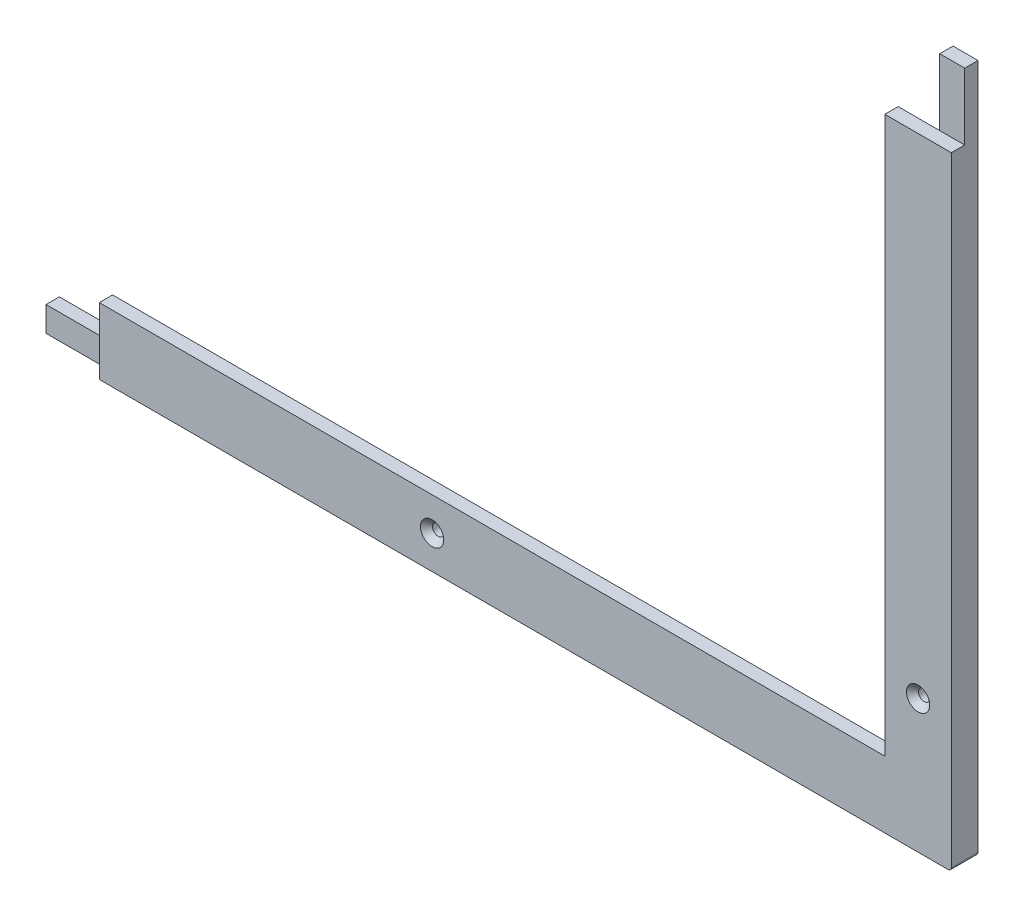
SolidWorks part; units mm, degrees
ref_plane "Ebene vorne" through (0, 0, 0) normal (0, 0, 1) x (1, 0, 0)
ref_plane "Ebene oben" through (0, 0, 0) normal (0, 1, 0) x (1, 0, 0)
ref_plane "Ebene rechts" through (0, 0, 0) normal (1, 0, 0) x (0, 0, -1)
sketch "Skizze1" plane through (0, 0, 0) normal (0, 0, 1) x (1, 0, 0)
  line L1 (-246, -177) -> (246, -177)
  line L2 (-246, -177) -> (-246, 177)
  line L3 (-246, 177) -> (246, 177)
  line L4 (246, -177) -> (246, 177)
  line L5 (-246, -177) -> (246, 177) construction
  line L6 (-246, 177) -> (246, -177) construction
  line L7 (-266, -197) -> (266, -197)
  line L8 (-266, -197) -> (-266, 197)
  line L9 (-266, 197) -> (266, 197)
  line L10 (266, -197) -> (266, 197)
  line L11 (-266, -197) -> (266, 197) construction
  line L12 (-266, 197) -> (266, -197) construction
  point P0 (0, 0)
  point P6 (0, 0)
  dimension "D1" = 532
  dimension "D2" = 394
  dimension "D3" = 20
  dimension "D4" = 20
extrude "Aufsatz-Linear austragen1" add sketch "Skizze1" along normal blind 8
fillet "Verrundung1" radius 1 4 edges at (-266, 197, 4) (-266, -197, 4) (266, -197, 4) (266, 197, 4)
sketch "Skizze2" plane through (0, 0, 0) normal (0, 0, -1) x (-1, 0, 0)
  line L0 (-266, -196) -> (-266, 196) construction
  line L1 (-258.5, 189.5) -> (258.5, 189.5)
  line L2 (-258.5, 189.5) -> (-258.5, -189.5)
  line L3 (-258.5, -189.5) -> (258.5, -189.5)
  line L4 (258.5, 189.5) -> (258.5, -189.5)
  line L5 (-265, 197) -> (265, 197) construction
  line L6 (266, 196) -> (266, -196) construction
  line L7 (265, -197) -> (-265, -197) construction
  dimension "D1" = 7.5
  dimension "D2" = 7.5
  dimension "D3" = 7.5
  dimension "D4" = 7.5
extrude "Schnitt-Linear austragen1" cut sketch "Skizze2" against normal blind 4
hole_wizard "Formsenkung für M3 Senkschraube mit Innensechskant1" positions "Skizze3" profile "Skizze4" countersink size "M3" standard "DIN"
sketch "Skizze3" plane through (0, 0, 8) normal (0, 0, 1) x (1, 0, 0)
  line L0 (-266, 196) -> (-266, -196) construction
  line L1 (266, -196) -> (266, 196) construction
  line L2 (-265, -197) -> (265, -197) construction
  line L3 (265, 197) -> (-265, 197) construction
  point P0 (-110, -187)
  point P2 (110, -187)
  point P4 (110, 187)
  point P6 (-110, 187)
  point P8 (256, 157)
  point P10 (256, -157)
  point P12 (-256, -157)
  point P14 (-256, 157)
  point P26 (-256, 0)
  point P32 (256, 0)
  dimension "D1" = 156
  dimension "D2" = 156
  dimension "D3" = 10
  dimension "D4" = 10
  dimension "D5" = 10
  dimension "D6" = 10
  dimension "D7" = 40
  dimension "D8" = 40
sketch "Skizze4" plane through (-110, -187, 8) normal (1, 0, 0) x (0, -1, 0)
  line L0 (0, 0) -> (0, 8)
  line L1 (0, 8) -> (1.7, 8)
  line L2 (1.7, 8) -> (1.7, 1.8)
  line L3 (1.7, 1.8) -> (3.5, 0)
  line L5 (3.5, 0) -> (0, 0)
  line L6 (-1.7, 1.8) -> (-3.5, 0) construction
  line L11 (0, -6.35) -> (0, 107.95) construction
  dimension "Bohrerdurchmesser" = 3.4
  dimension "Bohrungstiefe" = 8
  dimension "Senkdurchmesser (Oben)" = 7
  dimension "Senkwinkel (Oben)" = 90
sketch "Skizze5" plane through (0, 0, 0) normal (1, 0, 0) x (0, 0, -1)
  line L0 (-8, 197) -> (-8, -10)
  line L1 (-8, -196) -> (-8, 196) construction
  line L2 (-8, -10) -> (-4, -10)
  line L3 (-4, -10) -> (-4, 10)
  line L4 (-4, 10) -> (0, 10)
  line L5 (0, -196) -> (0, 196) construction
  line L6 (0, 10) -> (0, 197)
  line L7 (0, 197) -> (-8, 197)
  dimension "D1" = 10
  dimension "D2" = 10
  dimension "D3" = 4
extrude "Schnitt-Linear austragen2" cut sketch "Skizze5" along normal through all
sketch "Skizze6" plane through (0, 0, 0) normal (1, 0, 0) x (0, 0, -1)
  line L0 (-8, 197) -> (-8, -10)
  line L1 (-8, -196) -> (-8, -10) construction
  line L2 (-8, -10) -> (-4, -10)
  line L3 (-4, -10) -> (-4, 10)
  line L4 (-4, 10) -> (0, 10)
  line L5 (0, -196) -> (0, 10) construction
  line L6 (0, 10) -> (0, 197)
  line L7 (0, 197) -> (-8, 197)
  line L8 (-8, 197) -> (-8, 177) construction
  dimension "D1" = 10
  dimension "D2" = 4
  dimension "D3" = 10
extrude "Schnitt-Linear austragen3" cut sketch "Skizze6" against normal through all
sketch "Skizze7" plane through (0, 0, 0) normal (0, 1, 0) x (1, 0, 0)
  line L9 (-266, -8) -> (-266, 0)
  line L10 (-266, 0) -> (-10, 0)
  line L11 (258.5, 0) -> (-258.5, 0) construction
  line L12 (-10, 0) -> (-10, -4)
  line L13 (246, -4) -> (-246, -4) construction
  line L14 (-10, -4) -> (10, -4)
  line L15 (258.5, -4) -> (-258.5, -4) construction
  line L16 (10, -4) -> (10, -8)
  line L17 (-246, -8) -> (246, -8) construction
  line L18 (10, -8) -> (-266, -8)
  dimension "D1" = 10
  dimension "D2" = 10
extrude "Schnitt-Linear austragen4" cut sketch "Skizze7" against normal through all both and the other way through all
